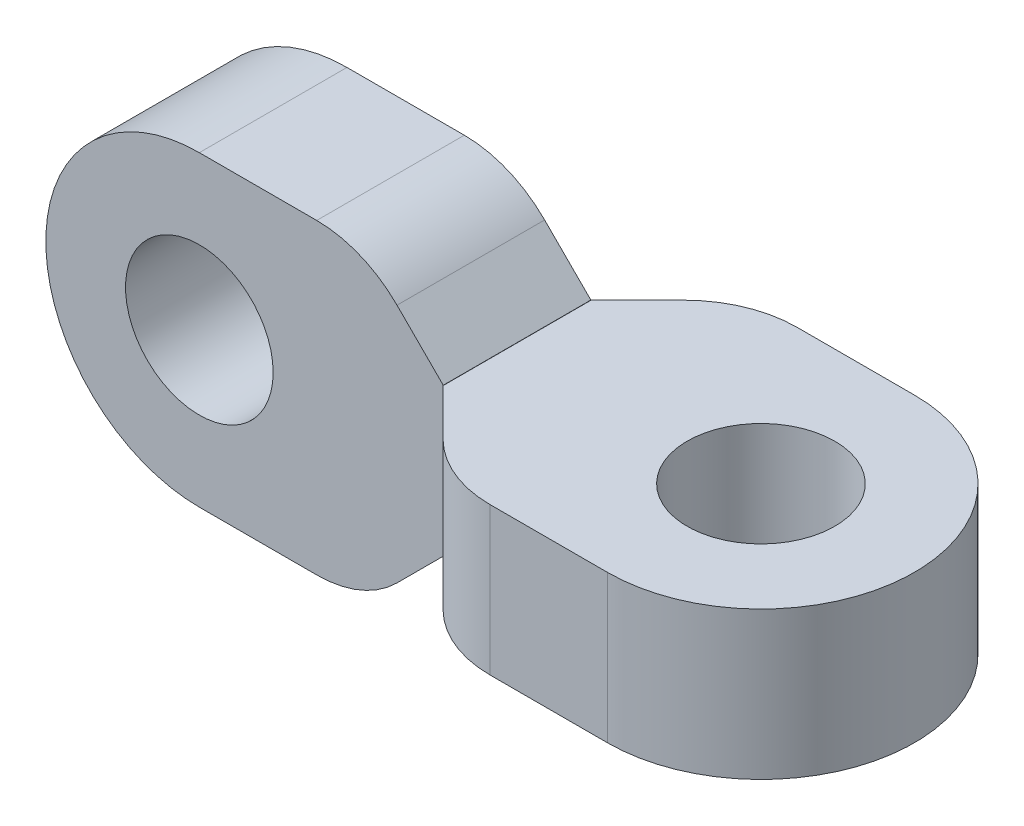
SolidWorks part; units mm, degrees
ref_plane "Front Plane" through (0, 0, 0) normal (0, 0, 1) x (1, 0, 0)
ref_plane "Top Plane" through (0, 0, 0) normal (0, 1, 0) x (1, 0, 0)
ref_plane "Right Plane" through (0, 0, 0) normal (1, 0, 0) x (0, 0, -1)
sketch "Sketch1" plane through (0, 0, 0) normal (0, 0, 1) x (1, 0, 0)
  line L0 (0, 8.5852) -> (0, -8.5852) construction
  line L9 (0, -8.5852) -> (13.6398, -8.5852)
  line L10 (13.6398, -8.5852) -> (13.6398, 8.5852)
  line L11 (13.6398, 8.5852) -> (0, 8.5852)
  arc A0 (0, 8.5852) -> (0, -8.5852) centre (0, 0) ccw
  circle A1 centre (0, 0) radius 4.1275
  dimension "D3" = 8.255
  dimension "D1" = 17.1704
  dimension "D2" = 22.225
extrude "Extrude1" add sketch "Sketch1" along normal mid plane 8.255
sketch "Sketch3" plane through (27.2796, 0, 0) normal (0, -1, 0) x (-1, 0, 0)
  line L0 (0, 8.5852) -> (0, -8.5852) construction
  line L1 (13.6398, -4.1275) -> (13.6398, 4.1275) construction
  line L9 (0, -8.5852) -> (13.6398, -8.5852)
  line L10 (13.6398, -8.5852) -> (13.6398, 8.5852)
  line L11 (13.6398, 8.5852) -> (0, 8.5852)
  arc A0 (0, 8.5852) -> (0, -8.5852) centre (0, 0) ccw
  circle A1 centre (0, 0) radius 4.1275
extrude "Extrude2" add sketch "Sketch3" along normal mid plane 8.255
chamfer "Chamfer1" distance 4.445 angle 45 4 edges at (13.6398, 0, 8.5852) (13.6398, 8.5852, 0) (13.6398, 0, -8.5852) (13.6398, -8.5852, 0)
fillet "Fillet2" radius 6.35 4 edges at (18.0848, 0, 8.5852) (9.1948, 8.5852, 0) (18.0848, 0, -8.5852) (9.1948, -8.5852, 0)
